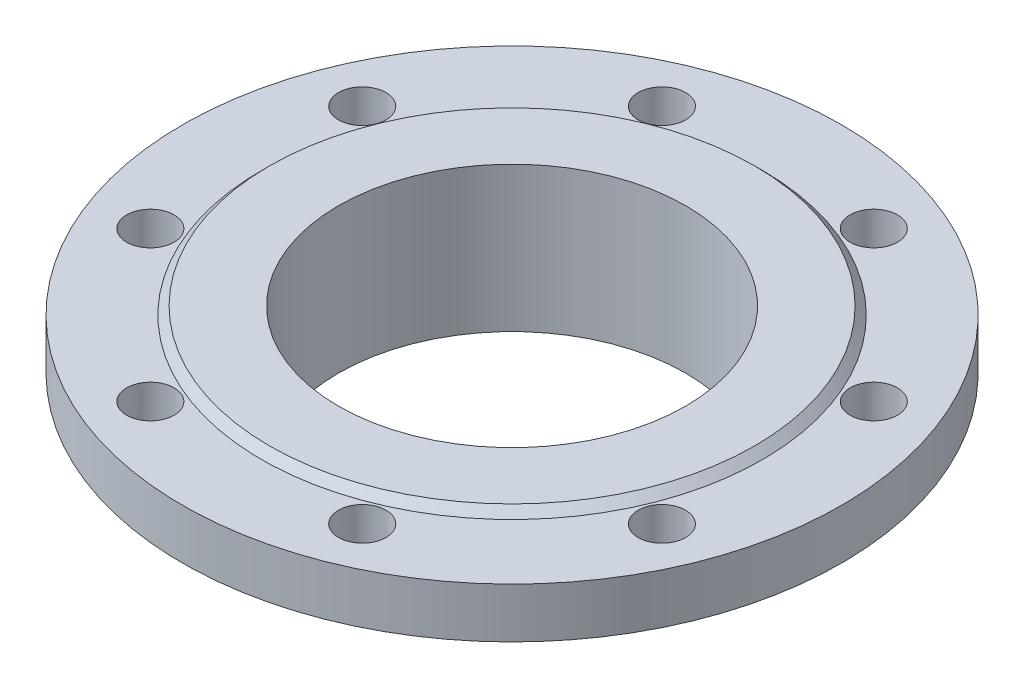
SolidWorks part; units mm, degrees
ref_plane "Plan de face" through (0, 0, 0) normal (0, 0, 1) x (1, 0, 0)
ref_plane "Plan de dessus" through (0, 0, 0) normal (0, 1, 0) x (1, 0, 0)
ref_plane "Plan de droite" through (0, 0, 0) normal (1, 0, 0) x (0, 0, -1)
sketch "Esquisse1" plane through (0, 0, 0) normal (0, 0, 1) x (1, 0, 0)
  line L0 (-400, 375) -> (-400, 491.8244) construction
  line L1 (-334.15, 375) -> (-465.85, 375) construction
  line L2 (-330.15, 375) -> (-330.15, 387)
  line L4 (-330.15, 387) -> (-321, 408)
  line L5 (-321, 408) -> (-275, 408)
  line L6 (-275, 408) -> (-275, 427)
  line L7 (-275, 427) -> (-305, 427)
  line L8 (-305, 427) -> (-308, 430)
  line L9 (-308, 430) -> (-334.15, 430)
  line L10 (-334.15, 430) -> (-334.15, 375)
  line L11 (-334.15, 375) -> (-330.15, 375)
  line L12 (-330.15, 375) -> (-469.85, 375) construction
  dimension "D1" = 12
  dimension "D2" = 250
  dimension "D3" = 184
  dimension "D4" = 3
  dimension "D5" = 3
  dimension "D6" = 55
  dimension "D7" = 22
  dimension "D8" = 158
  dimension "D9" = 4
  dimension "D10" = 139.7
revolve "Révolution1" add sketch "Esquisse1" angle 360 about L0
sketch "Esquisse2" plane through (0, 427, 0) normal (0, 1, 0) x (1, 0, 0)
  line L0 (-302.9926, 40.1818) -> (-400, 0) construction
  line L1 (-400, 0) -> (-275, 0) construction
  circle A0 centre (-302.9926, 40.1818) radius 9
  circle A1 centre (-400, 0) radius 125 construction
  circle A2 centre (-302.9926, -40.1818) radius 9
  circle A3 centre (-359.8182, -97.0074) radius 9
  circle A4 centre (-440.1818, -97.0074) radius 9
  circle A5 centre (-497.0074, -40.1818) radius 9
  circle A6 centre (-497.0074, 40.1818) radius 9
  circle A7 centre (-440.1818, 97.0074) radius 9
  circle A8 centre (-359.8182, 97.0074) radius 9
  dimension "D3" = 18
  dimension "D1" = 22.5
  dimension "D2" = 105
extrude "Enlèv. mat.-Extru.1" cut sketch "Esquisse2" against normal through all
